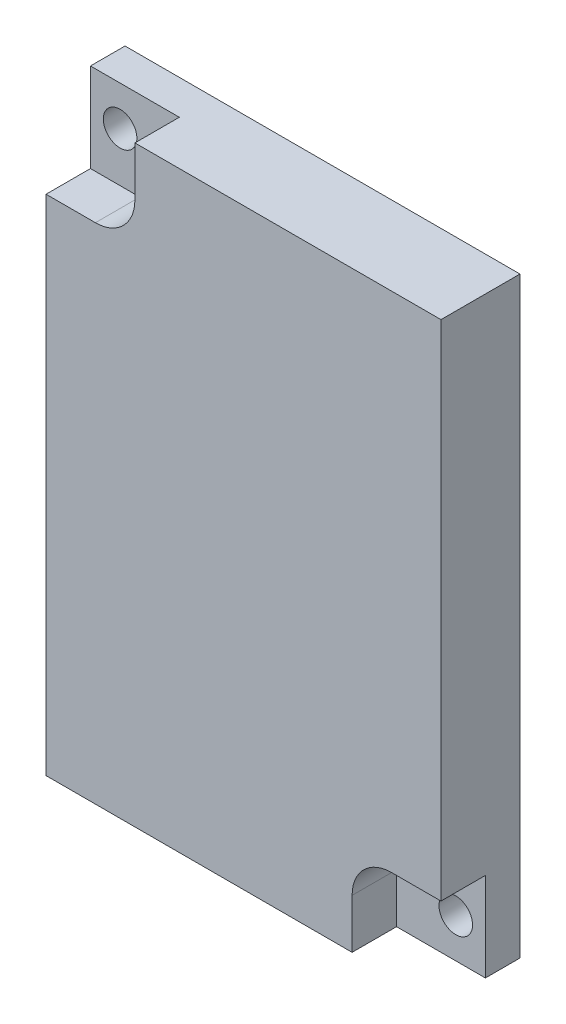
SolidWorks part; units mm, degrees
ref_plane "Plan de face" through (0, 0, 0) normal (0, 0, 1) x (1, 0, 0)
ref_plane "Plan de dessus" through (0, 0, 0) normal (0, 1, 0) x (1, 0, 0)
ref_plane "Plan de droite" through (0, 0, 0) normal (1, 0, 0) x (0, 0, -1)
sketch "Esquisse1" plane through (0, 0, 0) normal (0, 0, 1) x (1, 0, 0)
  line L1 (0, 0) -> (40, 0)
  line L2 (0, 0) -> (0, 60)
  line L3 (0, 60) -> (40, 60)
  line L4 (40, 0) -> (40, 60)
  dimension "D1" = 40
  dimension "D2" = 60
extrude "Extrusion1" add sketch "Esquisse1" along normal blind 8
sketch "Esquisse2" plane through (0, 0, 8) normal (0, 0, 1) x (1, 0, 0)
  line L0 (40, 60) -> (0, 60) construction
  line L1 (0, 51) -> (9, 51)
  line L2 (0, 51) -> (0, 60)
  line L3 (0, 60) -> (9, 60)
  line L4 (9, 51) -> (9, 60)
  line L5 (0, 60) -> (0, 0) construction
  line L6 (40, 0) -> (40, 60) construction
  line L8 (31, 0) -> (40, 0)
  line L9 (31, 0) -> (31, 9)
  line L10 (31, 9) -> (40, 9)
  line L11 (40, 0) -> (40, 9)
  line L12 (0, 0) -> (40, 0) construction
  dimension "D1" = 9
  dimension "D2" = 9
  dimension "D3" = 9
extrude "Enlèv. mat.-Extru.1" cut sketch "Esquisse2" against normal blind 4.5
hole_wizard "Dégagement M31" positions "Esquisse8" profile "Esquisse7" hole size "M3" standard "DIN"
sketch "Esquisse8" plane through (0, 0, 3.5) normal (0, 0, 1) x (1, 0, 0)
  line L0 (9, 60) -> (0, 60) construction
  line L3 (31, 0) -> (40, 0) construction
  line L4 (40, 9) -> (40, 60) construction
  line L5 (0, 60) -> (0, 51) construction
  point P0 (3, 56)
  point P10 (37, 4)
  dimension "D1" = 4
  dimension "D2" = 3
  dimension "D3" = 4
  dimension "D4" = 3
sketch "Esquisse7" plane through (3, 56, 3.5) normal (1, 0, 0) x (0, -1, 0)
  line L0 (0, 0) -> (0, 3.5)
  line L1 (0, 3.5) -> (1.7, 3.5)
  line L2 (1.7, 3.5) -> (1.7, 0)
  line L5 (1.7, 0) -> (0, 0)
  line L11 (0, -6.35) -> (0, 107.95) construction
  dimension "Diamètre du perçage jusqu'au prochain" = 3.4
  dimension "Profondeur du perçage jusqu'au prochain" = 3.5
fillet "Congé1" radius 4 2 edges at (31, 9, 5.75) (9, 51, 5.75)
ref_plane "MILIEU" through (20, 0, 0) normal (1, 0, 0) x (0, 0, -1)
ref_plane "Plan1" through (0, 30, 0) normal (0, 1, 0) x (-1, 0, 0)
